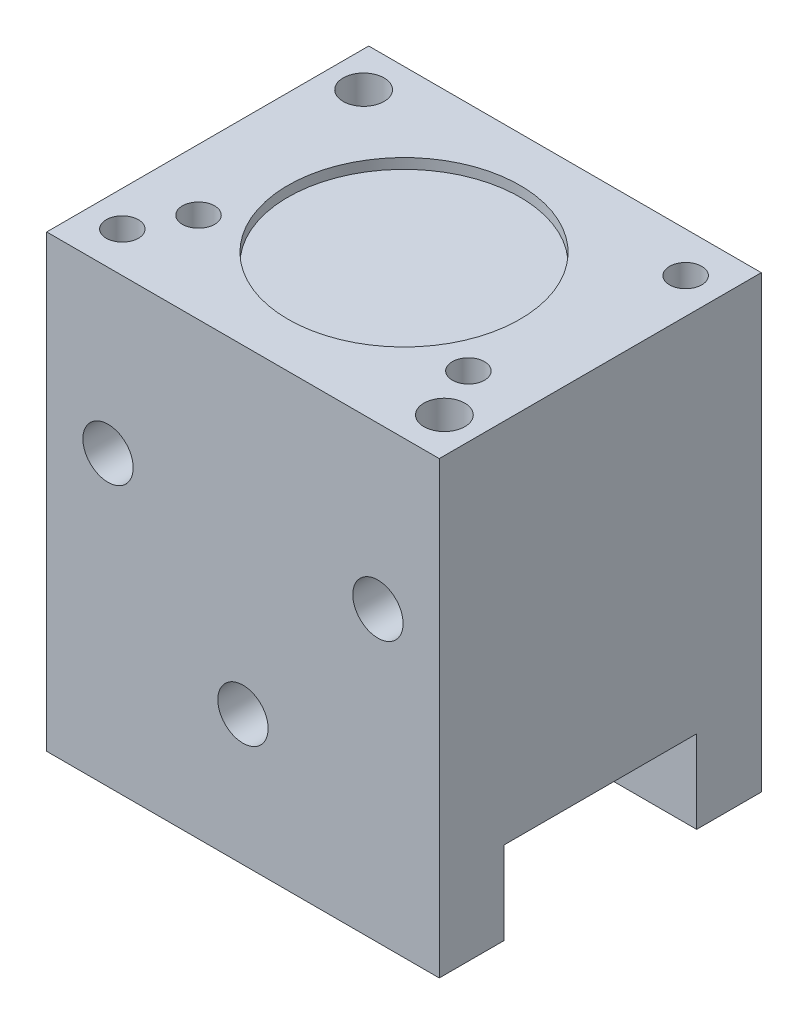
SolidWorks part; units mm, degrees
ref_plane "Front/Back" through (0, 0, 0) normal (0, 0, 1) x (1, 0, 0)
ref_plane "Top/Bottom" through (0, 0, 0) normal (0, 1, 0) x (1, 0, 0)
ref_plane "Right/Left" through (0, 0, 0) normal (1, 0, 0) x (0, 0, -1)
sketch "Sketch1" plane through (0, 0, 0) normal (0, 1, 0) x (1, 0, 0)
  line L0 (0, 0) -> (9.7536, 0) construction
  line L1 (-9.7536, 8.001) -> (9.7536, 8.001)
  line L2 (-9.7536, 8.001) -> (-9.7536, -8.001)
  line L3 (-9.7536, -8.001) -> (9.7536, -8.001)
  line L4 (9.7536, 8.001) -> (9.7536, -8.001)
  line L5 (0, 0) -> (0, 8.001) construction
  dimension "D1" = 19.5072
  dimension "D2" = 16.002
extrude "Extrude1" add sketch "Sketch1" along normal mid plane 22.352
hole_wizard "M2x0.4 (Mount Holes)" positions "Sketch3" profile "Sketch2" tap size "M2x0.4" standard "ANSI Metric"
sketch "Sketch3" plane through (0, 11.176, 0) normal (0, 1, 0) x (-1, 0, 0)
  line L0 (0, 0) -> (0, 8.4799) construction
  line L1 (0, 0) -> (12.3025, 0) construction
  point P0 (8.001, 5.9944)
  point P1 (-8.001, -5.9944)
  dimension "D1" = 8.001
  dimension "D2" = 5.9944
  dimension "D3" = 5.9944
  dimension "D4" = 8.001
  dimension "D5" = 16.002
  dimension "D6" = 11.9888
sketch "Sketch2" plane through (-8.001, 11.176, 5.9944) normal (1, 0, 0) x (0, 0, 1)
  line L0 (0, 0) -> (0, 7.3133)
  line L1 (0, 7.3133) -> (0.8, 6.8326)
  line L2 (0.8, 6.8326) -> (0.8, 0)
  line L5 (0.8, 0) -> (0, 0)
  line L10 (0, 7.3133) -> (-0.8, 6.8326) construction
  line L11 (0, -6.35) -> (0, 107.95) construction
  dimension "Tap Drill Dia." = 1.6
  dimension "Tap Drill Depth" = 6.8326
  dimension "Drill Angle" = 118
hole_wizard "M2x0.4 (Optional Air Ports)" positions "Sketch5" profile "Sketch4" tap size "M2x0.4" standard "ANSI Metric"
sketch "Sketch5" plane through (0, 11.176, 0) normal (0, 1, 0) x (-1, 0, 0)
  line L0 (0, 0) -> (0, 8.4213) construction
  line L1 (0, 0) -> (10.9258, 0) construction
  point P0 (6.7056, 3.5052)
  point P1 (-6.7056, 3.5052)
  dimension "D1" = 3.5052
  dimension "D2" = 13.4112
sketch "Sketch4" plane through (-6.7056, 11.176, 3.5052) normal (1, 0, 0) x (0, 0, 1)
  line L0 (0, 0) -> (0, 7.3133)
  line L1 (0, 7.3133) -> (0.8, 6.8326)
  line L2 (0.8, 6.8326) -> (0.8, 0)
  line L5 (0.8, 0) -> (0, 0)
  line L10 (0, 7.3133) -> (-0.8, 6.8326) construction
  line L11 (0, -6.35) -> (0, 107.95) construction
  dimension "Tap Drill Dia." = 1.6
  dimension "Tap Drill Depth" = 6.8326
  dimension "Drill Angle" = 118
sketch "Sketch6" plane through (0, 11.176, 0) normal (0, 1, 0) x (-1, 0, 0)
  line L0 (0, 0) -> (0, 8.3042) construction
  line L1 (0, 0) -> (10.9258, 0) construction
  circle A0 centre (-8.001, 5.9944) radius 1.016
  circle A1 centre (8.001, -5.9944) radius 1.016
  dimension "D1" = 2.032
extrude "2mm Dowel Holes - Slip Fit" cut sketch "Sketch6" against normal blind 1.5875
sketch "Sketch7" plane through (0, 11.176, 0) normal (0, 1, 0) x (-1, 0, 0)
  circle A0 centre (0, 0) radius 5.7658
  dimension "D1" = 11.5316
extrude "Cut-Extrude2" cut sketch "Sketch7" against normal blind 0.508
hole_wizard "M3x0.5 (Air Ports)" positions "Sketch9" profile "Sketch8" tap size "M3x0.5" standard "Ansi Metric"
sketch "Sketch9" plane through (0, 0, 8.001) normal (0, 0, 1) x (1, 0, 0)
  line L0 (0, 0) -> (0, 11.845) construction
  line L1 (0, 10.668) -> (0, 11.176) construction
  line L2 (0, 0) -> (10.8016, 0) construction
  line L4 (-9.7536, 11.176) -> (9.7536, 11.176) construction
  point P0 (-6.7056, 3.175)
  point P1 (6.7056, 3.175)
  dimension "D1" = 13.4112
  dimension "D2" = 8.001
sketch "Sketch8" plane through (-6.7056, 3.175, 8.001) normal (1, 0, 0) x (0, -1, 0)
  line L0 (0, 0) -> (0, 9.2511)
  line L1 (0, 9.2511) -> (1.25, 8.5)
  line L2 (1.25, 8.5) -> (1.25, 0)
  line L5 (1.25, 0) -> (0, 0)
  line L10 (0, 9.2511) -> (-1.25, 8.5) construction
  line L11 (0, -6.35) -> (0, 107.95) construction
  dimension "Tap Drill Dia." = 2.5
  dimension "Tap Drill Depth" = 8.5
  dimension "Drill Angle" = 118
hole_wizard "M3x0.5 (Exhaust)" positions "Sketch11" profile "Sketch10" tap size "M3x0.5" standard "Ansi Metric"
sketch "Sketch11" plane through (0, 0, 8.001) normal (0, 0, 1) x (1, 0, 0)
  line L0 (0, 0) -> (0, 14.0475) construction
  line L1 (0, 10.668) -> (0, 11.176) construction
  line L2 (-9.7536, 11.176) -> (9.7536, 11.176) construction
  point P0 (0, -4.699)
  dimension "D1" = 15.875
sketch "Sketch10" plane through (0, -4.699, 8.001) normal (1, 0, 0) x (0, -1, 0)
  line L0 (0, 0) -> (0, 9.2511)
  line L1 (0, 9.2511) -> (1.25, 8.5)
  line L2 (1.25, 8.5) -> (1.25, 0)
  line L5 (1.25, 0) -> (0, 0)
  line L10 (0, 9.2511) -> (-1.25, 8.5) construction
  line L11 (0, -6.35) -> (0, 107.95) construction
  dimension "Tap Drill Dia." = 2.5
  dimension "Tap Drill Depth" = 8.5
  dimension "Drill Angle" = 118
sketch "Sketch12" plane through (0, -11.176, 0) normal (0, -1, 0) x (1, 0, 0)
  line L0 (9.7536, 8.001) -> (9.7536, -8.001) construction
  line L1 (9.7536, 4.7879) -> (-9.7536, 4.7879)
  line L2 (9.7536, 4.7879) -> (9.7536, -4.7879)
  line L3 (9.7536, -4.7879) -> (-9.7536, -4.7879)
  line L4 (-9.7536, 4.7879) -> (-9.7536, -4.7879)
  line L5 (-9.7536, -8.001) -> (-9.7536, 8.001) construction
  line L6 (0, 0) -> (10.4088, 0) construction
  line L7 (0, 0) -> (0, 10.391) construction
  line L8 (0, -0.499) -> (0, 8.001) construction
  dimension "D1" = 9.5758
extrude "Cut-Extrude3" cut sketch "Sketch12" against normal blind 4.1148
sketch "Sketch13" plane through (0, -7.0612, 0) normal (0, -1, 0) x (1, 0, 0)
  circle A0 centre (0, 0) radius 4.4704
  dimension "D1" = 8.9408
extrude "Cut-Extrude4" cut sketch "Sketch13" against normal blind 4.1148
hole_wizard "#2-56 Tapped Hole1" positions "Sketch15" profile "Sketch14" tap size "#2-56" standard "Ansi Inch"
sketch "Sketch15" plane through (0, -11.176, 0) normal (0, -1, 0) x (1, 0, 0)
  line L0 (0, 0) -> (0, 8.5971) construction
  line L1 (0, 4.2921) -> (0, 8.001) construction
  line L2 (0, 0) -> (10.8965, 0) construction
  point P0 (-5.842, 6.1722)
  point P1 (5.842, 6.1722)
  point P2 (5.842, -6.1722)
  point P3 (-5.842, -6.1722)
  dimension "D1" = 6.1722
  dimension "D2" = 12.3444
  dimension "D3" = 11.684
sketch "Sketch14" plane through (-5.842, -11.176, 6.1722) normal (1, 0, 0) x (0, 0, -1)
  line L0 (0, 0) -> (0, 7.1763)
  line L1 (0, 7.1763) -> (0.889, 6.6421)
  line L2 (0.889, 6.6421) -> (0.889, 0)
  line L5 (0.889, 0) -> (0, 0)
  line L10 (0, 7.1763) -> (-0.889, 6.6421) construction
  line L11 (0, -6.35) -> (0, 107.95) construction
  dimension "Tap Drill Dia." = 1.778
  dimension "Tap Drill Depth" = 6.6421
  dimension "Drill Angle" = 118
